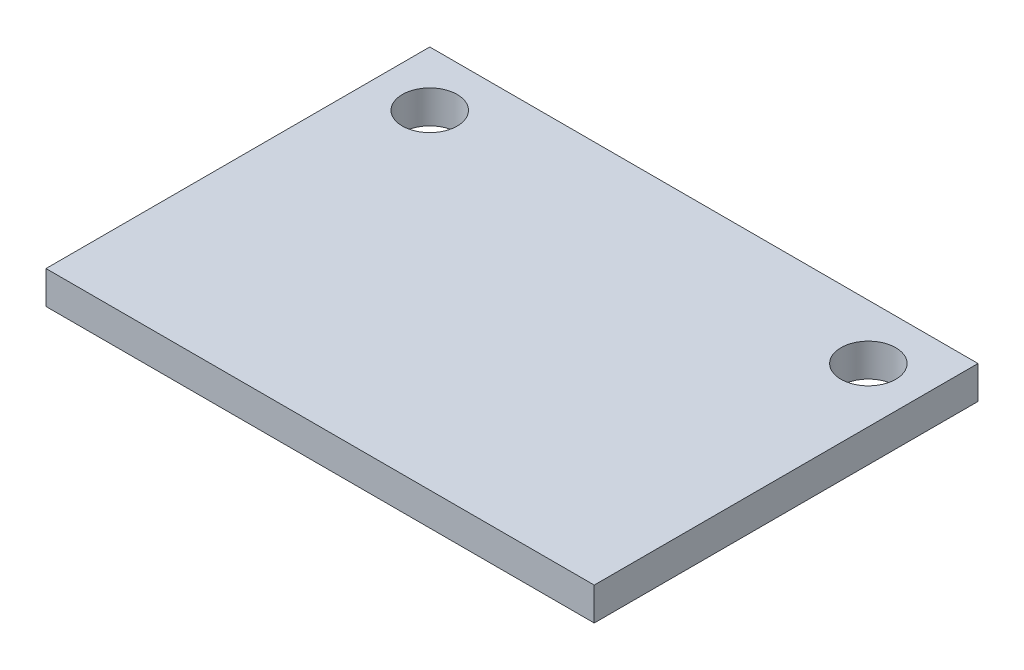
SolidWorks part; units mm, degrees
ref_plane "Front Plane" through (0, 0, 0) normal (0, 0, 1) x (1, 0, 0)
ref_plane "Top Plane" through (0, 0, 0) normal (0, 1, 0) x (1, 0, 0)
ref_plane "Right Plane" through (0, 0, 0) normal (1, 0, 0) x (0, 0, -1)
sketch "Sketch1" plane through (0, 0, 0) normal (0, 1, 0) x (1, 0, 0)
  line L0 (0, 0) -> (0, 11.8406) construction
  line L1 (-12.7, 8.89) -> (12.7, 8.89)
  line L2 (-12.7, 8.89) -> (-12.7, -8.89)
  line L3 (-12.7, -8.89) -> (12.7, -8.89)
  line L4 (12.7, 8.89) -> (12.7, -8.89)
  line L5 (-12.7, 8.89) -> (12.7, -8.89) construction
  line L6 (-12.7, -8.89) -> (12.7, 8.89) construction
  circle A0 centre (-10.16, 6.35) radius 1.27
  circle A1 centre (10.16, 6.35) radius 1.27
  point P4 (0, 0)
  dimension "D3" = 20.32
  dimension "D4" = 2.54
  dimension "D1" = 17.78
  dimension "D2" = 25.4
  dimension "D5" = 2.54
extrude "Boss-Extrude1" add sketch "Sketch1" along normal blind 1.524
